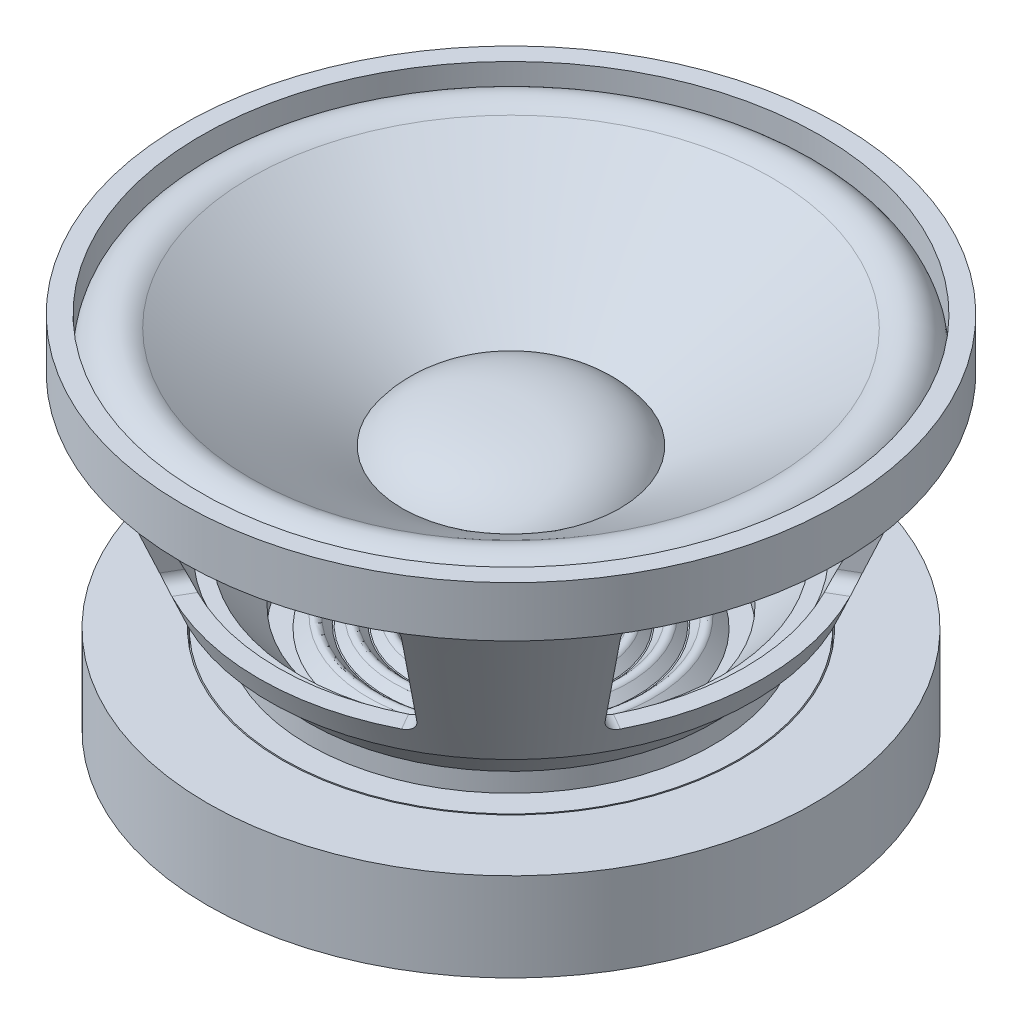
SolidWorks part; units mm, degrees
ref_plane "Front Plane" through (0, 0, 0) normal (0, 0, 1) x (1, 0, 0)
ref_plane "Top Plane" through (0, 0, 0) normal (0, 1, 0) x (1, 0, 0)
ref_plane "Right Plane" through (0, 0, 0) normal (1, 0, 0) x (0, 0, -1)
sketch "Sketch1" plane through (0, 0, 0) normal (0, 0, 1) x (1, 0, 0)
  line L0 (0, 0) -> (0, 25.904) construction
  line L1 (0, 0) -> (18, 0)
  line L2 (18, 0) -> (18, 1.5)
  line L3 (18, 1.5) -> (24, 1.5)
  line L4 (24, 1.5) -> (24, 8.5)
  line L5 (24, 8.5) -> (16, 8.5)
  line L6 (16, 8.5) -> (16, 10)
  line L7 (16, 10) -> (18.1006, 13)
  line L8 (18.1006, 13) -> (19.1006, 13)
  line L9 (19.1006, 13) -> (24.5, 26)
  line L13 (24.5, 26) -> (26, 26)
  line L14 (26, 26) -> (26, 30)
  line L15 (26, 30) -> (24.5, 30)
  line L16 (24.5, 30) -> (24.5, 27)
  line L17 (-1.3132, 24.041) -> (1.3132, 24.041) construction
  line L18 (0, 24.041) -> (0, 0)
  line L19 (7.2154, 23.0393) -> (9.9934, 18.9607) construction
  arc A0 (24.5, 27) -> (20.6044, 29.0742) centre (22, 27) ccw
  spline S0 degree 3 poles (8.6044, 21) (6.8681, 23.5492) (3.3333, 24.041) (0, 24.041) knots 0 0 0 0 1 1 1 1
  spline S1 degree 3 poles (20.6044, 29.0742) (16.6918, 26.4416) (12.5569, 23.9627) (8.6044, 21) knots 0 0 0 0 1 1 1 1
  dimension "D7" = 1.5
  dimension "D14" = 2.5
  dimension "D18" = 2
  dimension "D20" = 10
  dimension "D2" = 49
  dimension "D3" = 7
  dimension "D4" = 1
  dimension "D5" = 1.5
  dimension "D6" = 4
  dimension "D8" = 9
  dimension "D9" = 8
  dimension "D10" = 30
  dimension "D11" = 1.5
  dimension "D12" = 3
  dimension "D13" = 1
  dimension "D15" = 13
  dimension "D16" = 35
  dimension "D17" = 12
  dimension "D19" = 2
  dimension "D21" = 52
revolve "Revolve1" add sketch "Sketch1" angle 360 about L0
sketch "Sketch2" plane through (0, 0, 0) normal (0, 0, 1) x (1, 0, 0)
  line L0 (0, 0) -> (0, 30.318) construction
  line L1 (19.9313, 15) -> (14.9313, 15)
  line L2 (19.1006, 13) -> (24.5, 26) construction
  line L3 (14.9313, 15) -> (19.0847, 25)
  line L4 (19.0847, 25) -> (24.0847, 25)
  line L5 (24.0847, 25) -> (19.9313, 15)
  line L6 (-24.5, 26) -> (24.5, 26) construction
  line L7 (-18.1006, 13) -> (18.1006, 13) construction
  dimension "D1" = 1
  dimension "D2" = 2
  dimension "D3" = 5
sketch "Sketch3" plane through (0, 0, 0) normal (0, 0, 1) x (1, 0, 0)
  line L0 (5.0509, 8.5) -> (13.6519, 8.5)
  line L1 (16, 8.5) -> (-16, 8.5) construction
  line L2 (13.6519, 8.5) -> (13.6519, 10)
  line L3 (16, 10) -> (-16, 10) construction
  line L5 (0, 0) -> (0, 28.4989) construction
  line L6 (21.8975, 22.2868) -> (17.773, 13.6009)
  line L7 (17.773, 13.6009) -> (16.6828, 13.6009)
  line L8 (16.6828, 13.6009) -> (13.6519, 10)
  spline S0 degree 3 poles (5.0509, 8.5) (6.4316, 14.4207) (16.5858, 22.0951) (20.2719, 23.9368) (22.5663, 24.5083) (21.8975, 22.2868) knots 0 0 0 0 0.666607 0.766607 1 1 1 1
revolve "Cut-Revolve1" cut sketch "Sketch3" angle 360 about L5
revolve "Cut-Revolve2" cut sketch "Sketch2" angle 60 mid plane about L0
fillet "Fillet1" radius 1 4 edges at (16.6141, 15, -9.5922) (18.6929, 25, -10.7923) (18.6929, 25, 10.7923) (16.6141, 15, 9.5922)
pattern_circular "CirPattern1" count 4 over 360 about axis through (0, 0, 0) along (0, 1, 0) of "Cut-Revolve2", "Fillet1"
sketch "Sketch4" plane through (0, 0, 0) normal (0, 0, 1) x (1, 0, 0)
  line L0 (0, 0) -> (0, 14.8851) construction
  line L1 (5.7, 8.5) -> (12.2, 8.5)
  line L2 (24, 8.5) -> (-24, 8.5) construction
  line L3 (16, 8.5) -> (-16, 8.5) construction
  line L4 (13.6519, 8.5) -> (-13.6519, 8.5) construction
  line L5 (12.2, 8.5) -> (11.3036, 9.3964)
  line L6 (10.5964, 9.3964) -> (10, 8.8)
  line L7 (9.9, 8.8) -> (9.3036, 9.3964)
  line L8 (8.5964, 9.3964) -> (8, 8.8)
  line L9 (7.9, 8.8) -> (7.3036, 9.3964)
  line L10 (6.5964, 9.3964) -> (5.7, 8.5)
  line L11 (7.9, 8.8) -> (8, 8.8)
  line L12 (9.9, 8.8) -> (10, 8.8)
  line L13 (5.8691, 8.8309) -> (4.7981, 9.9019)
  line L14 (4.489, 9.289) -> (3.5293, 8.3293)
  line L15 (10.95, 9.75) -> (10.95, 8.5) construction
  arc A0 (7.3036, 9.3964) -> (6.5964, 9.3964) centre (6.95, 9.0429) ccw
  arc A1 (9.3036, 9.3964) -> (8.5964, 9.3964) centre (8.95, 9.0429) ccw
  arc A2 (11.3036, 9.3964) -> (10.5964, 9.3964) centre (10.95, 9.0429) ccw
  point P20 (6.95, 9.75)
  point P28 (8.95, 9.75)
  dimension "D7" = 0.5
  dimension "D1" = 6.5
  dimension "D3" = 0.3
  dimension "D4" = 2
  dimension "D5" = 5.7
  dimension "D6" = 45
  dimension "D2" = 4
revolve "Revolve2" add sketch "Sketch4" angle 360 about L0
sketch "Sketch5" plane through (0, 1.5, 0) normal (0, -1, 0) x (1, 0, 0)
  circle A0 centre (0, 0) radius 18 construction
  circle A1 centre (0, 0) radius 18
extrude "Cut-Extrude-Thin1" cut sketch "Sketch5" against normal blind 10 thin
